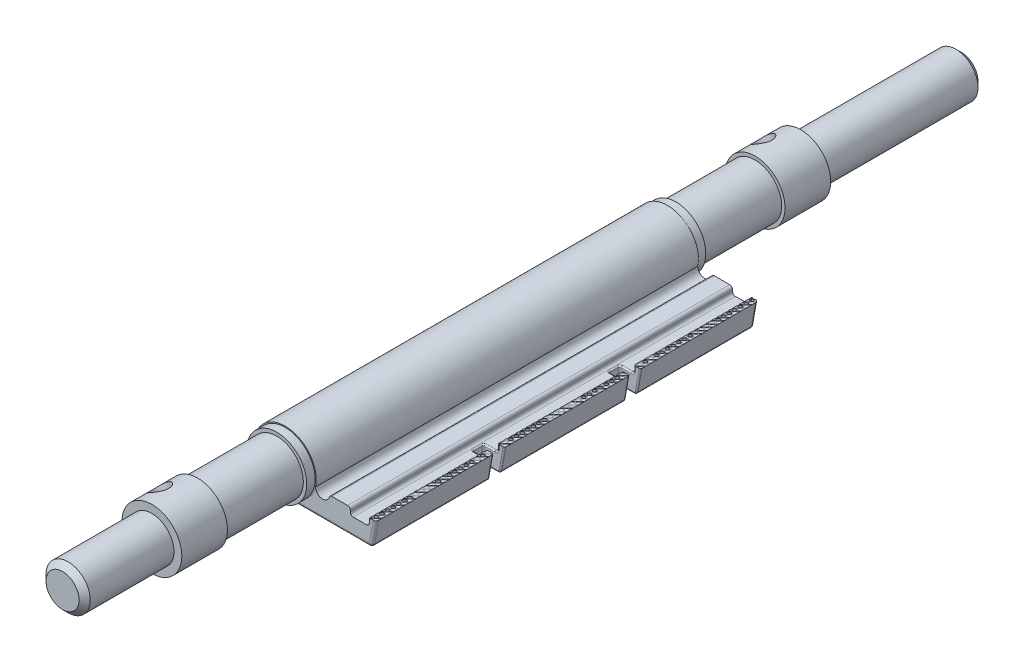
SolidWorks part; units mm, degrees
ref_plane "Plan de face" through (0, 0, 0) normal (0, 0, 1) x (1, 0, 0)
ref_plane "Plan de dessus" through (0, 0, 0) normal (0, 1, 0) x (1, 0, 0)
ref_plane "Plan de droite" through (0, 0, 0) normal (1, 0, 0) x (0, 0, -1)
imported_body "Cylindre"
imported_body "Plat"
fillet "Congé rainures" radius 1
fillet "Congé plat" radius 1 7 edges at (31.6425, -6.7, -55.5) (30.8666, -11.1, -34.5) (30.8666, -11.1, 12.75) (30.8666, -11.1, 60) (31.6337, -6.75, 81)
fillet "Congé encoches" radius 0.5 32 edges at (29.7662, -4.6071, 35.1) (29.7662, -4.6071, 39) (30.6703, -10.866, 35.1) (30.6703, -10.866, 39) (31.7153, -6.2868, 35.1) (31.7065, -6.3368, 39) (31.7153, -6.2868, -13.5) (30.6703, -10.866, -13.5) (29.7662, -4.6071, -13.5) (29.7662, -4.6071, -9.6) (30.6703, -10.866, -9.6) (31.7153, -6.2868, -9.6)
